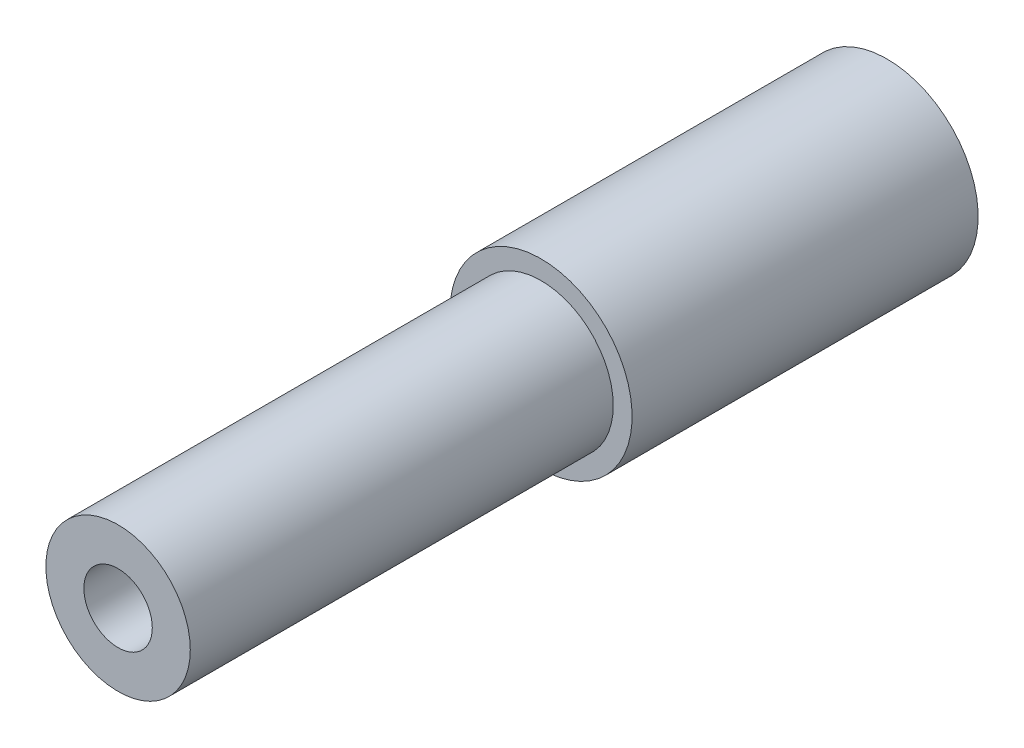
SolidWorks part; units mm, degrees
ref_plane "Front Plane" through (0, 0, 0) normal (0, 0, 1) x (1, 0, 0)
ref_plane "Top Plane" through (0, 0, 0) normal (0, 1, 0) x (1, 0, 0)
ref_plane "Right Plane" through (0, 0, 0) normal (1, 0, 0) x (0, 0, -1)
sketch "Sketch1" plane through (0, 0, 0) normal (0, 0, 1) x (1, 0, 0)
  circle A0 centre (0, 0) radius 2.3851
  dimension "D1" = 4.7701
extrude "Extrude1" add sketch "Sketch1" against normal blind 25.4
sketch "Sketch2" plane through (0, 0, -25.4) normal (0, 0, -1) x (-1, 0, 0)
  circle A0 centre (0, 0) radius 3.0074
  dimension "D1" = 6.0147
extrude "Extrude2" add sketch "Sketch2" against normal blind 11.43
hole_wizard "#4-40 Tapped Hole1" positions "3DSketch1" profile "Sketch3" tap size "#4-40" standard "Ansi Inch"
sketch3d "3DSketch1"
  point P0 (0, 0, 0)
sketch "Sketch3" plane through (0, 0, 0) normal (1, 0, 0) x (0, -1, 0)
  line L0 (0, 0) -> (0, 9.5438)
  line L1 (0, 9.5438) -> (1.1303, 8.8646)
  line L2 (1.1303, 8.8646) -> (1.1303, 0)
  line L5 (1.1303, 0) -> (0, 0)
  line L10 (0, 9.5438) -> (-1.1303, 8.8646) construction
  line L11 (0, -6.35) -> (0, 107.95) construction
  dimension "Tap Drill Dia." = 2.2606
  dimension "Tap Drill Depth" = 8.8646
  dimension "Drill Angle" = 118
